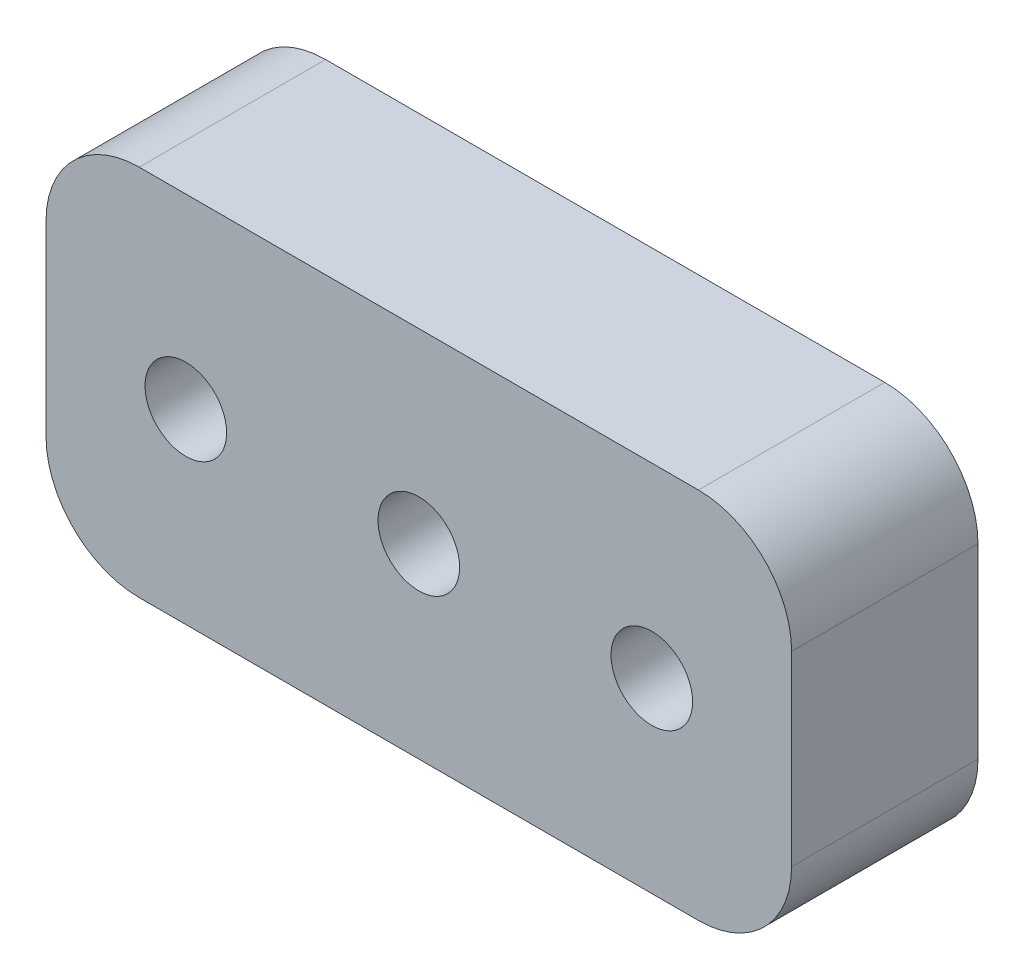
SolidWorks part; units mm, degrees
ref_plane "Front Plane" through (0, 0, 0) normal (0, 0, 1) x (1, 0, 0)
ref_plane "Top Plane" through (0, 0, 0) normal (0, 1, 0) x (1, 0, 0)
ref_plane "Right Plane" through (0, 0, 0) normal (1, 0, 0) x (0, 0, -1)
sketch "Sketch1" plane through (0, 0, 0) normal (0, 0, 1) x (1, 0, 0)
  line L0 (-25.4, 0) -> (-15.875, 0) construction
  line L1 (-25.4, 12.7) -> (25.4, 12.7)
  line L2 (-25.4, 12.7) -> (-25.4, -12.7)
  line L3 (-25.4, -12.7) -> (25.4, -12.7)
  line L4 (25.4, 12.7) -> (25.4, -12.7)
  line L5 (-25.4, 12.7) -> (25.4, -12.7) construction
  line L6 (-25.4, -12.7) -> (25.4, 12.7) construction
  line L7 (0, 0) -> (15.875, 0) construction
  circle A0 centre (15.875, 0) radius 2.7788
  circle A1 centre (0, 0) radius 2.7788
  circle A2 centre (-15.875, 0) radius 2.7788
  point P0 (0, 0)
  dimension "D1" = 25.4
  dimension "D3" = 5.5575
  dimension "D4" = 5.5575
  dimension "D2" = 50.8
  dimension "D5" = 9.525
  dimension "D6" = 9.525
extrude "Boss-Extrude1" add sketch "Sketch1" along normal blind 12.7
fillet "Fillet1" radius 6.35 4 edges at (25.4, 12.7, 6.35) (-25.4, 12.7, 6.35) (25.4, -12.7, 6.35) (-25.4, -12.7, 6.35)
chamfer "Chamfer1" [suppressed] distance 0.635 angle 45
